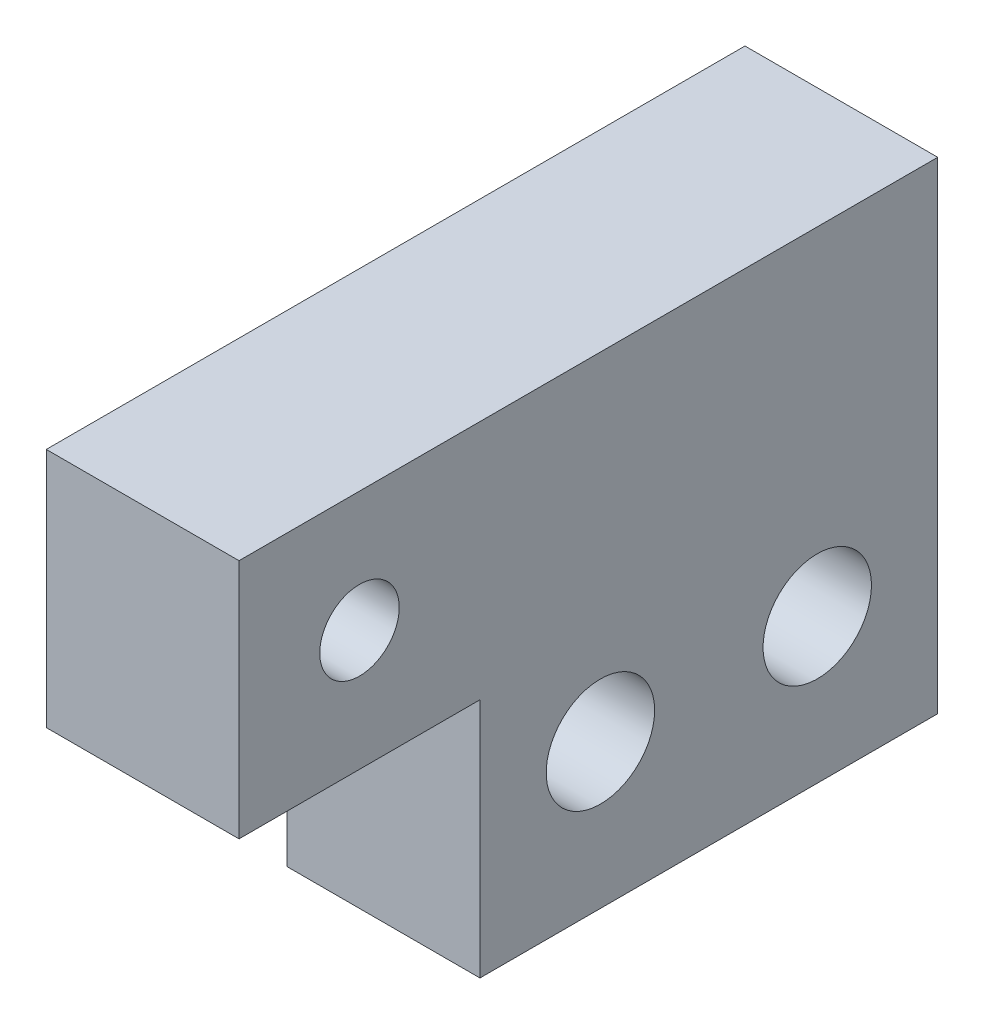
SolidWorks part; units mm, degrees
ref_plane "前视基准面" through (0, 0, 0) normal (0, 0, 1) x (1, 0, 0)
ref_plane "上视基准面" through (0, 0, 0) normal (0, 1, 0) x (1, 0, 0)
ref_plane "右视基准面" through (0, 0, 0) normal (1, 0, 0) x (0, 0, -1)
sketch "草图1" plane through (0, 0, 0) normal (0, 0, 1) x (1, 0, 0)
  line L0 (8, 0) -> (8, 20)
  line L1 (0, 0) -> (0, 20)
  line L2 (0, 0) -> (8, 0)
  line L3 (0, 20) -> (8, 20)
extrude "凸台-拉伸1" add sketch "草图1" along normal blind 29
sketch "草图2" plane through (8, 0, 0) normal (1, 0, 0) x (0, 0, -1)
  line L0 (-29, 20) -> (0, 20)
  line L1 (-19, 0) -> (0, 0)
  line L2 (0, 0) -> (0, 20)
  line L3 (-29, 10) -> (-29, 20)
  line L4 (-19, 0) -> (-19, 10)
  line L5 (-29, 10) -> (-19, 10)
  circle A1 centre (-14, 6) radius 2.25
  circle A2 centre (-5, 6) radius 2.25
  circle A3 centre (-24, 15) radius 1.65
extrude "切除-拉伸1" cut sketch "草图2" against normal blind 29 flip side to cut
sketch "草图3" plane through (8, 0, 0) normal (1, 0, 0) x (0, 0, -1)
  circle A0 centre (-14, 6) radius 4 construction
  circle A1 centre (-5, 6) radius 4 construction
sketch "草图4" plane through (0, 0, 0) normal (-1, 0, 0) x (0, 0, 1)
  circle A0 centre (5, 6) radius 4
  circle A1 centre (14, 6) radius 4
extrude "切除-拉伸2" cut sketch "草图4" against normal blind 4.5
